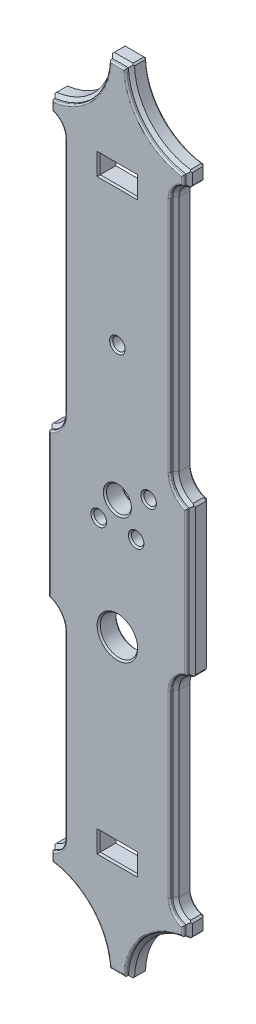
SolidWorks part; units mm, degrees
ref_plane "Спереди" through (0, 0, 0) normal (0, 0, 1) x (1, 0, 0)
ref_plane "Сверху" through (0, 0, 0) normal (0, 1, 0) x (1, 0, 0)
ref_plane "Справа" through (0, 0, 0) normal (1, 0, 0) x (0, 0, -1)
sketch "Эскиз1" plane through (0, 0, 0) normal (0, 0, 1) x (1, 0, 0)
  line L0 (-6, -51) -> (6, -51) construction
  line L1 (0, -43.06) -> (0, -51) construction
  line L2 (0, 78.7442) -> (0, -175.2558) construction
  line L3 (6, -138.06) -> (-6, -138.06)
  line L4 (6, -138.06) -> (6, -144.06)
  line L5 (6, -144.06) -> (-6, -144.06)
  line L6 (-6, -138.06) -> (-6, -144.06)
  line L7 (6, -138.06) -> (-6, -144.06) construction
  line L8 (6, -144.06) -> (-6, -138.06) construction
  line L9 (6, 50) -> (-6, 50)
  line L10 (6, 50) -> (6, 44)
  line L11 (6, 44) -> (-6, 44)
  line L12 (-6, 50) -> (-6, 44)
  line L13 (6, 50) -> (-6, 44) construction
  line L14 (6, 44) -> (-6, 50) construction
  line L15 (-23, -34.0777) -> (-23, -81.7405)
  line L16 (-17.75, 48.9184) -> (-17.75, -27.3)
  line L17 (-17.75, -87.91) -> (-17.75, -145.43)
  line L18 (-22, -150.1536) -> (-22, -154.8536)
  line L19 (-3.5, -175.2558) -> (3.5, -175.2558)
  line L20 (-3.5, 78.7442) -> (3.5, 78.7442)
  line L21 (-22, 53.642) -> (-22, 58.342)
  line L22 (22, -150.1536) -> (22, -154.8536)
  line L23 (17.75, -87.91) -> (17.75, -145.43)
  line L24 (23, -34.0777) -> (23, -81.7405)
  line L25 (17.75, 48.9184) -> (17.75, -27.3)
  line L26 (22, 53.642) -> (22, 58.342)
  circle A0 centre (0, 0) radius 2
  circle A1 centre (0, -43.06) radius 4
  circle A2 centre (0, -81.06) radius 6
  circle A3 centre (-6, -51) radius 2
  circle A4 centre (6, -51) radius 2
  circle A5 centre (10, -37.9) radius 2
  arc A6 (-23, -34.0777) -> (-17.75, -27.3) centre (-24.75, -27.3) ccw
  arc A7 (-17.75, -87.91) -> (-23, -81.7405) centre (-24, -87.91) ccw
  arc A8 (-22, -150.1536) -> (-17.75, -145.43) centre (-22.5, -145.43) ccw
  arc A9 (-3.5, -175.2558) -> (-22, -154.8536) centre (-24, -175.2558) ccw
  arc A10 (-22, 58.342) -> (-3.5, 78.7442) centre (-24, 78.7442) ccw
  arc A11 (-17.75, 48.9184) -> (-22, 53.642) centre (-22.5, 48.9184) ccw
  arc A12 (3.5, -175.2558) -> (22, -154.8536) centre (24, -175.2558) cw
  arc A13 (22, -150.1536) -> (17.75, -145.43) centre (22.5, -145.43) cw
  arc A14 (17.75, -87.91) -> (23, -81.7405) centre (24, -87.91) cw
  arc A15 (23, -34.0777) -> (17.75, -27.3) centre (24.75, -27.3) cw
  arc A16 (17.75, 48.9184) -> (22, 53.642) centre (22.5, 48.9184) cw
  arc A17 (22, 58.342) -> (3.5, 78.7442) centre (24, 78.7442) cw
  point P14 (0, -141.06)
  point P19 (0, 47)
  dimension "D1" = 4
  dimension "D2" = 8
  dimension "D3" = 12
  dimension "D20" = 14
  dimension "D21" = 12.5
  dimension "D25" = 9.5
  dimension "D28" = 41
  dimension "D4" = 81.06
  dimension "D5" = 38
  dimension "D6" = 12
  dimension "D7" = 30.06
  dimension "D8" = 43.16
  dimension "D9" = 10
  dimension "D10" = 57
  dimension "D11" = 6
  dimension "D12" = 12
  dimension "D13" = 6
  dimension "D14" = 44
  dimension "D15" = 12
  dimension "D16" = 254
  dimension "D17" = 46
  dimension "D18" = 35.5
  dimension "D19" = 10.6
  dimension "D22" = 6.85
  dimension "D23" = 44
  dimension "D24" = 1.37
  dimension "D26" = 4.7
  dimension "D27" = 7
extrude "Бобышка-Вытянуть1" add sketch "Эскиз1" along normal blind 6
sketch "Эскиз2" plane through (0, 0, 6) normal (0, 0, 1) x (1, 0, 0)
  line L0 (-22, -34.8125) -> (-22, -80.9413)
  line L1 (-16.75, 48.9184) -> (-16.75, -27.3)
  line L2 (-21, 57.4545) -> (-21, 54.4693)
  line L3 (2.5233, 77.7442) -> (-2.5233, 77.7442)
  line L4 (21, 54.4693) -> (21, 57.4545)
  line L5 (16.75, -27.3) -> (16.75, 48.9184)
  line L6 (22, -80.9413) -> (22, -34.8125)
  line L7 (16.75, -145.43) -> (16.75, -87.91)
  line L8 (21, -153.9661) -> (21, -150.9809)
  line L9 (-2.5233, -174.2558) -> (2.5233, -174.2558)
  line L10 (-21, -150.9809) -> (-21, -153.9661)
  line L11 (-16.75, -87.91) -> (-16.75, -145.43)
  line L12 (-23, -34.0777) -> (-23, -81.7405)
  line L13 (-17.75, -87.91) -> (-17.75, -145.43)
  line L14 (-22, -150.1536) -> (-22, -154.8536)
  line L15 (-3.5, -175.2558) -> (3.5, -175.2558)
  line L16 (22, -154.8536) -> (22, -150.1536)
  line L17 (17.75, -145.43) -> (17.75, -87.91)
  line L18 (23, -81.7405) -> (23, -34.0777)
  line L19 (17.75, -27.3) -> (17.75, 48.9184)
  line L20 (22, 53.642) -> (22, 58.342)
  line L21 (3.5, 78.7442) -> (-3.5, 78.7442)
  line L22 (-22, 58.342) -> (-22, 53.642)
  line L23 (-17.75, 48.9184) -> (-17.75, -27.3)
  line L24 (-23, -34.0777) -> (-23, -81.7405)
  line L25 (-17.75, -87.91) -> (-17.75, -145.43)
  line L26 (-22, -150.1536) -> (-22, -154.8536)
  line L27 (-3.5, -175.2558) -> (3.5, -175.2558)
  line L28 (22, -154.8536) -> (22, -150.1536)
  line L29 (17.75, -145.43) -> (17.75, -87.91)
  line L30 (23, -81.7405) -> (23, -34.0777)
  line L31 (17.75, -27.3) -> (17.75, 48.9184)
  line L32 (22, 53.642) -> (22, 58.342)
  line L33 (3.5, 78.7442) -> (-3.5, 78.7442)
  line L34 (-22, 58.342) -> (-22, 53.642)
  line L35 (-17.75, 48.9184) -> (-17.75, -27.3)
  arc A0 (-16.75, -87.91) -> (-22, -80.9413) centre (-24, -87.91) ccw
  arc A1 (-22, -34.8125) -> (-16.75, -27.3) centre (-24.75, -27.3) ccw
  arc A2 (-16.75, 48.9184) -> (-21, 54.4693) centre (-22.5, 48.9184) ccw
  arc A3 (-21, 57.4545) -> (-2.5233, 77.7442) centre (-24, 78.7442) ccw
  arc A4 (2.5233, 77.7442) -> (21, 57.4545) centre (24, 78.7442) ccw
  arc A5 (21, 54.4693) -> (16.75, 48.9184) centre (22.5, 48.9184) ccw
  arc A6 (16.75, -27.3) -> (22, -34.8125) centre (24.75, -27.3) ccw
  arc A7 (22, -80.9413) -> (16.75, -87.91) centre (24, -87.91) ccw
  arc A8 (16.75, -145.43) -> (21, -150.9809) centre (22.5, -145.43) ccw
  arc A9 (21, -153.9661) -> (2.5233, -174.2558) centre (24, -175.2558) ccw
  arc A10 (-2.5233, -174.2558) -> (-21, -153.9661) centre (-24, -175.2558) ccw
  arc A11 (-21, -150.9809) -> (-16.75, -145.43) centre (-22.5, -145.43) ccw
  arc A12 (-23, -34.0777) -> (-17.75, -27.3) centre (-24.75, -27.3) ccw
  arc A13 (-17.75, -87.91) -> (-23, -81.7405) centre (-24, -87.91) ccw
  arc A14 (-22, -150.1536) -> (-17.75, -145.43) centre (-22.5, -145.43) ccw
  arc A15 (-3.5, -175.2558) -> (-22, -154.8536) centre (-24, -175.2558) ccw
  arc A16 (22, -154.8536) -> (3.5, -175.2558) centre (24, -175.2558) ccw
  arc A17 (17.75, -145.43) -> (22, -150.1536) centre (22.5, -145.43) ccw
  arc A18 (23, -81.7405) -> (17.75, -87.91) centre (24, -87.91) ccw
  arc A19 (17.75, -27.3) -> (23, -34.0777) centre (24.75, -27.3) ccw
  arc A20 (22, 53.642) -> (17.75, 48.9184) centre (22.5, 48.9184) ccw
  arc A21 (3.5, 78.7442) -> (22, 58.342) centre (24, 78.7442) ccw
  arc A22 (-22, 58.342) -> (-3.5, 78.7442) centre (-24, 78.7442) ccw
  arc A23 (-17.75, 48.9184) -> (-22, 53.642) centre (-22.5, 48.9184) ccw
  arc A24 (-23, -34.0777) -> (-17.75, -27.3) centre (-24.75, -27.3) ccw
  arc A25 (-17.75, -87.91) -> (-23, -81.7405) centre (-24, -87.91) ccw
  arc A26 (-22, -150.1536) -> (-17.75, -145.43) centre (-22.5, -145.43) ccw
  arc A27 (-3.5, -175.2558) -> (-22, -154.8536) centre (-24, -175.2558) ccw
  arc A28 (22, -154.8536) -> (3.5, -175.2558) centre (24, -175.2558) ccw
  arc A29 (17.75, -145.43) -> (22, -150.1536) centre (22.5, -145.43) ccw
  arc A30 (23, -81.7405) -> (17.75, -87.91) centre (24, -87.91) ccw
  arc A31 (17.75, -27.3) -> (23, -34.0777) centre (24.75, -27.3) ccw
  arc A32 (22, 53.642) -> (17.75, 48.9184) centre (22.5, 48.9184) ccw
  arc A33 (3.5, 78.7442) -> (22, 58.342) centre (24, 78.7442) ccw
  arc A34 (-22, 58.342) -> (-3.5, 78.7442) centre (-24, 78.7442) ccw
  arc A35 (-17.75, 48.9184) -> (-22, 53.642) centre (-22.5, 48.9184) ccw
  dimension "D1" = 0
  dimension "D2" = 1
extrude "Вырез-Вытянуть1" cut sketch "Эскиз2" against normal blind 1
chamfer "Фаска1" distance 1 angle 45 24 edges at (22, -152.5036, 5) (8.8137, -161.4854, 5) (0, -175.2558, 5) (-8.8137, -161.4854, 5) (-22, -152.5036, 5) (18.9689, -148.6071, 5) (17.75, -116.67, 5) (19.2401, -83.8595, 5) (23, -57.9091, 5) (-18.9689, -148.6071, 5) (-17.75, -116.67, 5) (-19.2401, -83.8595, 5) (-23, -57.9091, 5) (-19.216, -31.5866, 5) (19.216, -31.5866, 5) (-17.75, 10.8092, 5) (17.75, 10.8092, 5) (-18.9689, 52.0954, 5) (18.9689, 52.0954, 5) (22, 55.992, 5) (-22, 55.992, 5) (-8.8137, 64.9737, 5) (8.8137, 64.9737, 5) (0, 78.7442, 5)
fillet "Скругление1" radius 0.5 24 edges at (-17.9345, 52.4139, 6) (-16.75, 10.8092, 6) (17.9345, 52.4139, 6) (16.75, 10.8092, 6) (-18.2094, -83.5475, 6) (-16.75, -116.67, 6) (18.2094, -83.5475, 6) (16.75, -116.67, 6) (0, 77.7442, 6) (8.1036, 64.2682, 6) (21, 55.9619, 6) (-8.1036, 64.2682, 6) (-21, 55.9619, 6) (-18.1926, -31.8826, 6) (18.1926, -31.8826, 6) (22, -57.8769, 6) (-22, -57.8769, 6) (-17.9345, -148.9255, 6) (-21, -152.4735, 6) (-8.1036, -160.7798, 6) (17.9345, -148.9255, 6) (21, -152.4735, 6) (8.1036, -160.7798, 6) (0, -174.2558, 6)
chamfer "Фаска2" distance 0.5 angle 45 68 edges at (6, -81.06, 0) (6, -81.06, 6) (4, -43.06, 0) (4, -43.06, 6) (-4, -51, 0) (-4, -51, 6) (8, -51, 0) (8, -51, 6) (12, -37.9, 0) (12, -37.9, 6) (2, 0, 0) (2, 0, 6) (-22, -154.8536, 2) (-22, -150.1536, 2) (-22, -152.5036, 0) (-8.8137, -161.4854, 0) (0, -175.2558, 0) (8.8137, -161.4854, 0) (22, -152.5036, 0) (18.9689, -148.6071, 0) (17.75, -116.67, 0) (19.2401, -83.8595, 0) (23, -57.9091, 0) (-18.9689, -148.6071, 0) (-17.75, -116.67, 0) (-19.2401, -83.8595, 0) (-23, -57.9091, 0) (-19.216, -31.5866, 0) (19.216, -31.5866, 0) (-17.75, 10.8092, 0) (17.75, 10.8092, 0) (-18.9689, 52.0954, 0) (-22, 55.992, 0) (-8.8137, 64.9737, 0) (0, 78.7442, 0) (18.9689, 52.0954, 0) (22, 55.992, 0) (8.8137, 64.9737, 0) (0, 44, 0) (-6, 47, 0) (0, 50, 0) (6, 47, 0) (0, -138.06, 0) (6, -141.06, 0) (-6, -141.06, 0) (0, -144.06, 0) (6, -141.06, 6) (0, -144.06, 6) (-6, -141.06, 6) (0, -138.06, 6) (0, 44, 6) (6, 47, 6) (0, 50, 6) (-6, 47, 6) (-23, -81.7405, 2) (-23, -34.0777, 2) (-22, 58.342, 2) (-22, 53.642, 2) (22, 58.342, 2) (22, 53.642, 2) (23, -34.0777, 2) (23, -81.7405, 2) (22, -150.1536, 2) (22, -154.8536, 2) (3.5, -175.2558, 2) (-3.5, -175.2558, 2) (-3.5, 78.7442, 2) (3.5, 78.7442, 2)
